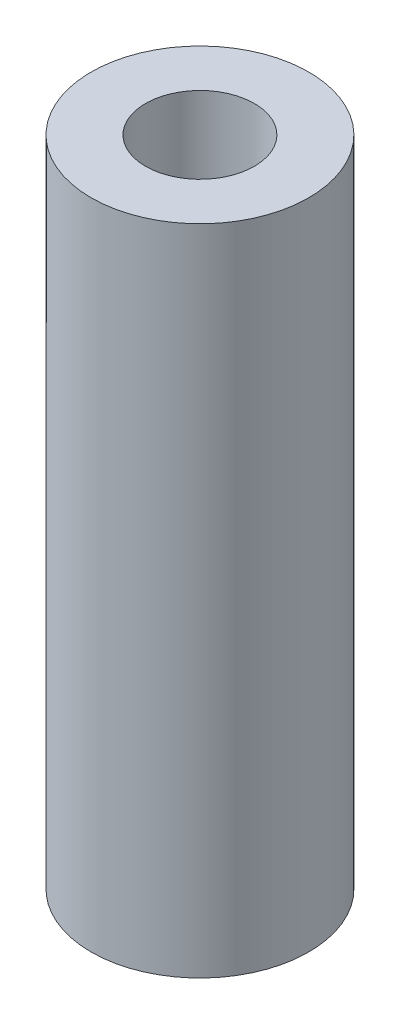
SolidWorks part; units mm, degrees
ref_plane "Front Plane" through (0, 0, 0) normal (0, 0, 1) x (1, 0, 0)
ref_plane "Top Plane" through (0, 0, 0) normal (0, 1, 0) x (1, 0, 0)
ref_plane "Right Plane" through (0, 0, 0) normal (1, 0, 0) x (0, 0, -1)
sketch "Sketch1" plane through (0, 0, 0) normal (0, 1, 0) x (1, 0, 0)
  circle A0 centre (0, 0) radius 6.35
  circle A1 centre (0, 0) radius 3.175
  dimension "D1" = 6.35
  dimension "D2" = 12.7
sketch "Sketch2" plane through (0, 0, 0) normal (0, 0, 1) x (1, 0, 0)
  line L0 (0, 0) -> (0, 38.1)
  dimension "D1" = 38.1
sweep "Sweep1" add profiles "Sketch1" path "Sketch2"
